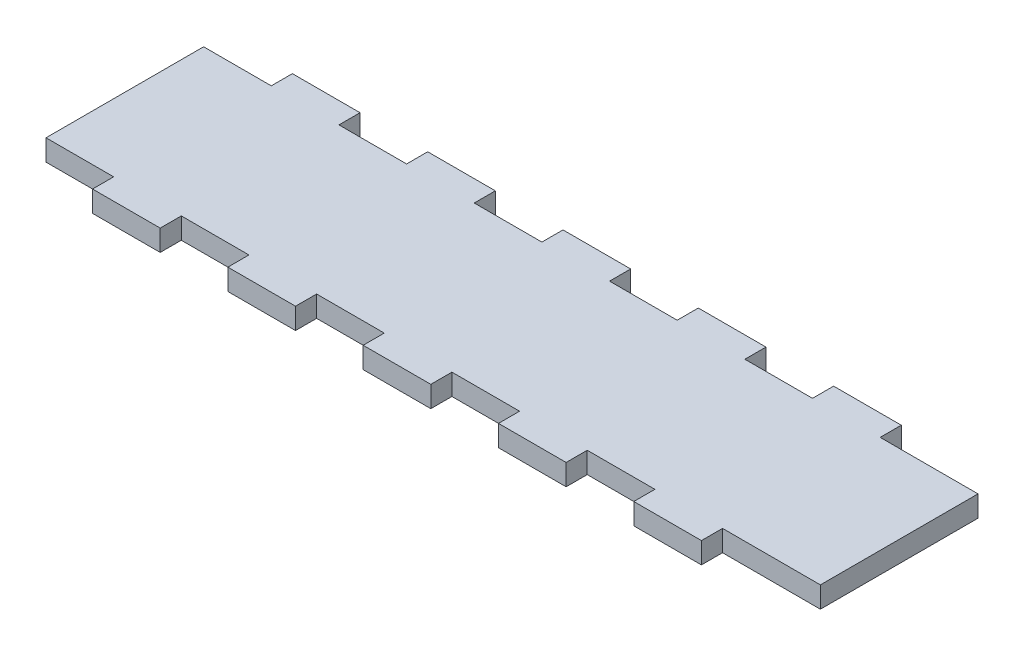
SolidWorks part; units mm, degrees
ref_plane "Front Plane" through (0, 0, 0) normal (0, 0, 1) x (1, 0, 0)
ref_plane "Top Plane" through (0, 0, 0) normal (0, 1, 0) x (1, 0, 0)
ref_plane "Right Plane" through (0, 0, 0) normal (1, 0, 0) x (0, 0, -1)
sketch "Sketch1" plane through (0, 0, 0) normal (0, 1, 0) x (1, 0, 0)
  line L1 (0, 16) -> (0, 12.62)
  line L2 (-65, 16) -> (-65, -16)
  line L3 (-65, -16) -> (59, -16)
  line L4 (59, 16) -> (59, -16)
  line L5 (-65, 16) -> (59, 16)
  line L6 (-43.3333, 12.62) -> (-32.5, 12.62)
  line L7 (-65, 12.62) -> (-54.1667, 12.62)
  line L8 (-54.1667, 12.62) -> (-54.1667, 16)
  line L10 (-43.3333, 16) -> (-43.3333, 12.62)
  line L11 (-65, 0) -> (59, 0) construction
  line L12 (-32.5, 12.62) -> (-32.5, 16)
  line L14 (-21.6667, 16) -> (-21.6667, 12.62)
  line L15 (-21.6667, 12.62) -> (-10.8333, 12.62)
  line L16 (-10.8333, 12.62) -> (-10.8333, 16)
  line L18 (0, 12.62) -> (10.8333, 12.62)
  line L19 (43.3333, -12.62) -> (59, -12.62)
  line L20 (10.8333, 12.62) -> (10.8333, 16)
  line L22 (21.6667, 16) -> (21.6667, 12.62)
  line L23 (21.6667, 12.62) -> (32.5, 12.62)
  line L24 (32.5, 12.62) -> (32.5, 16)
  line L26 (43.3333, 16) -> (43.3333, 12.62)
  line L27 (43.3333, 12.62) -> (59, 12.62)
  line L28 (43.3333, -16) -> (43.3333, -12.62)
  line L30 (32.5, -12.62) -> (32.5, -16)
  line L31 (21.6667, -12.62) -> (32.5, -12.62)
  line L32 (21.6667, -16) -> (21.6667, -12.62)
  line L33 (0, -16) -> (0, -12.62)
  line L34 (10.8333, -12.62) -> (10.8333, -16)
  line L35 (0, -12.62) -> (10.8333, -12.62)
  line L36 (-10.8333, -12.62) -> (-10.8333, -16)
  line L37 (-21.6667, -12.62) -> (-10.8333, -12.62)
  line L38 (-21.6667, -16) -> (-21.6667, -12.62)
  line L39 (-32.5, -12.62) -> (-32.5, -16)
  line L40 (-43.3333, -12.62) -> (-32.5, -12.62)
  line L41 (-43.3333, -16) -> (-43.3333, -12.62)
  line L42 (-54.1667, -12.62) -> (-54.1667, -16)
  line L43 (-65, -12.62) -> (-54.1667, -12.62)
  point P0 (0, 0)
extrude "Boss-Extrude1" add sketch "Sketch1" along normal blind 3.38
equation "\"length\" = 120mm"
equation "\"D1@Sketch4\"=\"length\"/12"
equation "\"D2@Sketch4\"=\"length\"/12"
equation "\"D3@Sketch4\"=\"length\"/12"
equation "\"D4@Sketch4\"=\"length\"/12"
equation "\"D5@Sketch4\"=\"length\"/12"
equation "\"D6@Sketch4\"=\"length\"/12"
equation "\"D7@Sketch4\"=\"length\"/12"
equation "\"D8@Sketch4\"=\"length\"/12"
equation "\"D9@Sketch4\"=\"length\"/12"
equation "\"D10@Sketch4\"=\"length\"/12"
equation "\"D11@Sketch4\"=\"length\"/12"
equation "\"thickness of material\"= 3.38mm"
equation "\"D12@Sketch4\"=\"thickness of material\""
equation "\"D13@Sketch4\"=\"thickness of material\""
equation "\"D14@Sketch4\"=\"thickness of material\""
equation "\"D15@Sketch4\"=\"thickness of material\""
equation "\"D16@Sketch4\"=\"thickness of material\""
equation "\"D17@Sketch4\"=\"thickness of material\""
equation "\"width\"= 130mm"
equation "\"D1@Sketch5\"=\"width\"/12"
equation "\"D2@Sketch5\"=\"width\"/12"
equation "\"D3@Sketch5\"=\"width\"/12"
equation "\"D4@Sketch5\"=\"width\"/12"
equation "\"D5@Sketch5\"=\"width\"/12"
equation "\"D6@Sketch5\"=\"width\"/12"
equation "\"D7@Sketch5\"=\"width\"/12"
equation "\"D8@Sketch5\"=\"width\"/12"
equation "\"D9@Sketch5\"=\"width\"/12"
equation "\"D10@Sketch5\"=\"width\"/12"
equation "\"D11@Sketch5\"=\"thickness of material\""
equation "\"D12@Sketch5\"=\"thickness of material\""
equation "\"D13@Sketch5\"=\"thickness of material\""
equation "\"D14@Sketch5\"=\"thickness of material\""
equation "\"D15@Sketch5\"=\"thickness of material\""
equation "\"D3@Sketch1\"=\"width\"/12"
equation "\"D4@Sketch1\"=\"width\"/12"
equation "\"D6@Sketch1\"=\"width\"/12"
equation "\"D7@Sketch1\"=\"width\"/12"
equation "\"D8@Sketch1\"=\"width\"/12"
equation "\"D10@Sketch1\"=\"width\"/12"
equation "\"D11@Sketch1\"=\"width\"/12"
equation "\"D12@Sketch1\"=\"width\"/12"
equation "\"D9@Sketch1\"=\"width\"/12"
equation "\"D13@Sketch1\"=\"thickness of material\""
equation "\"D14@Sketch1\"=\"thickness of material\""
equation "\"D15@Sketch1\"=\"thickness of material\""
equation "\"D5@Sketch1\"=\"width\"/12"
equation "\"D16@Sketch1\"=\"thickness of material\""
equation "\"D17@Sketch1\"=\"thickness of material\""
equation "\"D18@Sketch1\"=\"thickness of material\""
equation "\"D19@Sketch1\"=\"thickness of material\""
equation "\"D20@Sketch1\"=\"thickness of material\""
equation "\"D21@Sketch1\"=\"thickness of material\""
equation "\"D22@Sketch1\"=\"thickness of material\""
equation "\"D23@Sketch1\"=\"thickness of material\""
equation "\"D1@Boss-Extrude1\"=\"thickness of material\""
